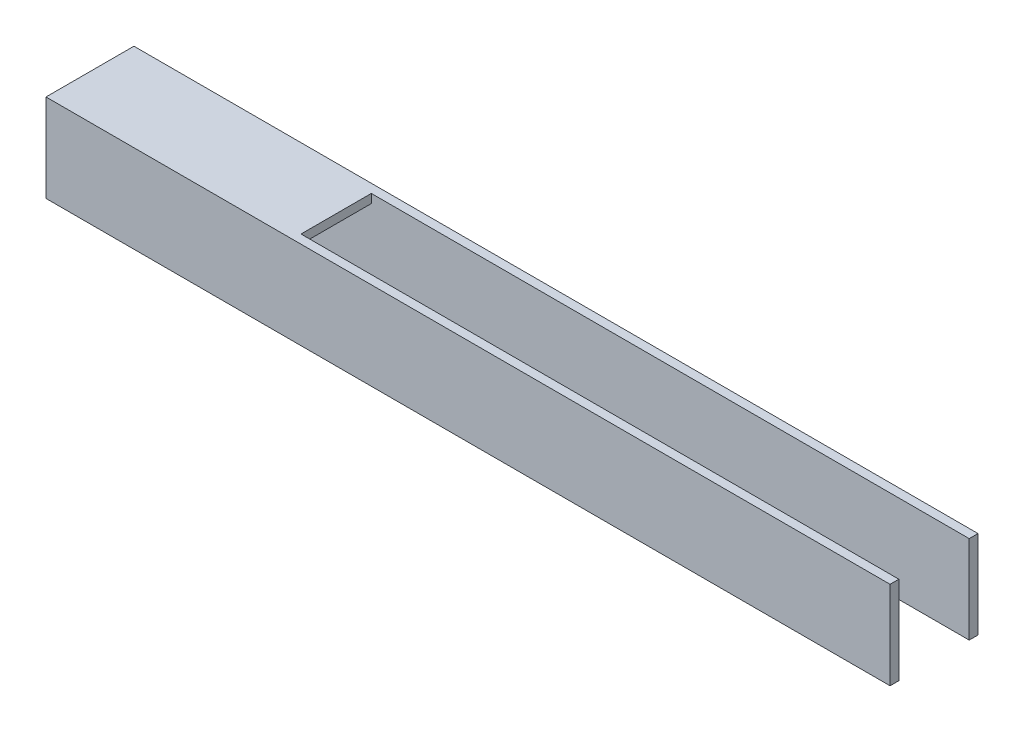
SolidWorks part; units mm, degrees
ref_plane "Front Plane" through (0, 0, 0) normal (0, 0, 1) x (1, 0, 0)
ref_plane "Top Plane" through (0, 0, 0) normal (0, 1, 0) x (1, 0, 0)
ref_plane "Right Plane" through (0, 0, 0) normal (1, 0, 0) x (0, 0, -1)
sketch "Sketch1" plane through (0, 0, 0) normal (1, 0, 0) x (0, 0, -1)
  line L0 (-15.875, 3.175) -> (15.875, 3.175)
  line L1 (15.875, -28.575) -> (12.7, -28.575)
  line L2 (12.7, -28.575) -> (12.7, 0)
  line L3 (12.7, 0) -> (-12.7, 0)
  line L4 (-12.7, 0) -> (-12.7, -28.575)
  line L5 (-12.7, -28.575) -> (-15.875, -28.575)
  line L6 (-15.875, -28.575) -> (-15.875, 3.175)
  line L7 (15.875, 3.175) -> (15.875, -28.575)
  point P3 (0, 0)
  point P10 (0, 3.175)
  dimension "D1" = 31.75
  dimension "D2" = 31.75
  dimension "D3" = 3.175
  dimension "D4" = 3.175
extrude "Boss-Extrude1" add sketch "Sketch1" along normal blind 304.8
sketch "Sketch2" plane through (0, 0, 0) normal (0, -1, 0) x (1, 0, 0)
  line L0 (304.8, 12.7) -> (0, 12.7) construction
  line L1 (304.8, -12.7) -> (88.9, -12.7)
  line L2 (304.8, -12.7) -> (304.8, 12.7)
  line L3 (304.8, 12.7) -> (88.9, 12.7)
  line L4 (88.9, -12.7) -> (88.9, 12.7)
  dimension "D1" = 215.9
extrude "Cut-Extrude1" cut sketch "Sketch2" against normal through all
